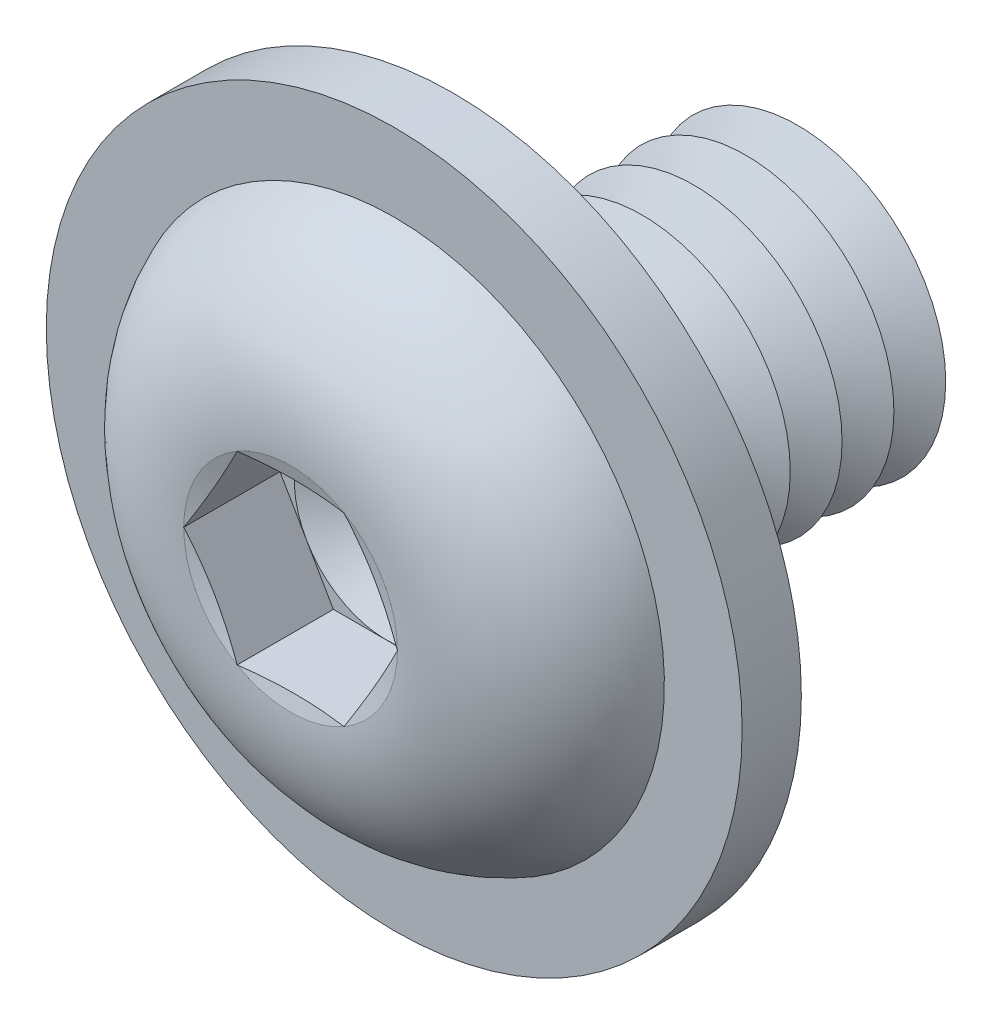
SolidWorks part; units mm, degrees
ref_plane "Front Plane" through (0, 0, 0) normal (0, 0, 1) x (1, 0, 0)
ref_plane "Top Plane" through (0, 0, 0) normal (0, 1, 0) x (1, 0, 0)
ref_plane "Right Plane" through (0, 0, 0) normal (1, 0, 0) x (0, 0, -1)
sketch "Sketch1" plane through (0, 0, 0) normal (1, 0, 0) x (0, 0, -1)
  line L0 (0, 2) -> (0, 3.8)
  line L3 (0, 2) -> (5, 2)
  line L4 (5, 2) -> (5, 0)
  line L5 (5, 0) -> (-2.2, 0) construction
  line L6 (-2.2, 0) -> (5, 0)
  line L7 (-2.2, 1.4434) -> (-2.2, 0.7217) construction
  line L8 (-2.2, 0.7217) -> (-2.2, 0)
  line L9 (-2.2, 1.4434) -> (-2.0066, 0.7217)
  line L10 (-2.0066, 0.7217) -> (-2.2, 0.7217)
  line L11 (5, 0) -> (22.7481, 0) construction
  line L12 (0, 3.8) -> (-2.2, 3.8) construction
  arc A1 (0, 3.8) -> (-2.2, 1.4434) centre (0, 1.5948) ccw
  point P8 (5, 1)
  dimension "D1" = 7.6
  dimension "D2" = 4
  dimension "D3" = 2.2
  dimension "D4" = 2.8868
  dimension "D5" = 5
  dimension "D6" = 15
revolve "Revolve1" add sketch "Sketch1" angle 360 about L5
fillet "Fillet1" radius 0.35 1 edges at (-2, 0, 0)
sketch "Sketch2" plane through (0, 0, 0) normal (1, 0, 0) x (0, 0, -1)
  line L0 (4.65, 2) -> (5.35, 2)
  line L1 (5, 2) -> (0.35, 2) construction
  line L2 (5.35, 2) -> (5, 1.3938)
  line L3 (5, -2) -> (5, 2) construction
  line L4 (5, 1.3938) -> (4.65, 2)
  dimension "D1" = 0.7
revolve "Cut-Revolve1" cut sketch "Sketch2" angle 360 about axis through (0, 0, -5) along (0, 0, -1)
pattern_linear "LPattern1" count 7 spacing 0.7 along (0, 0, 1) of "Cut-Revolve1"
sketch "Sketch3" plane through (0, 0, 2.2) normal (0, 0, 1) x (1, 0, 0)
  line L7 (0.7217, 1.25) -> (-0.7217, 1.25)
  line L8 (-0.7217, 1.25) -> (-1.4434, 0)
  line L9 (-1.4434, 0) -> (-0.7217, -1.25)
  line L10 (-0.7217, -1.25) -> (0.7217, -1.25)
  line L11 (0.7217, -1.25) -> (1.4434, 0)
  line L12 (1.4434, 0) -> (0.7217, 1.25)
  circle A0 centre (0, 0) radius 1.25 construction
  circle A3 centre (0, 0) radius 1.4434 construction
extrude "Cut-Extrude1" cut sketch "Sketch3" against normal blind 1.3
sketch "Sketch4" plane through (0, 0, 0.9) normal (0, 0, 1) x (1, 0, 0)
  line L1 (0.7217, 1.25) -> (-0.7217, 1.25) construction
  circle A0 centre (0, 0) radius 1.25
extrude "Cut-Extrude2" cut sketch "Sketch4" against normal through all draft 60
sketch "Sketch5" plane through (0, 0, 0) normal (0, 0, -1) x (-1, 0, 0)
  circle A0 centre (0, 0) radius 4.7
  circle A1 centre (0, 0) radius 2.35
  circle A2 centre (0, 0) radius 2.35 construction
  dimension "D1" = 9.4
extrude "Boss-Extrude1" add sketch "Sketch5" against normal blind 0.8
